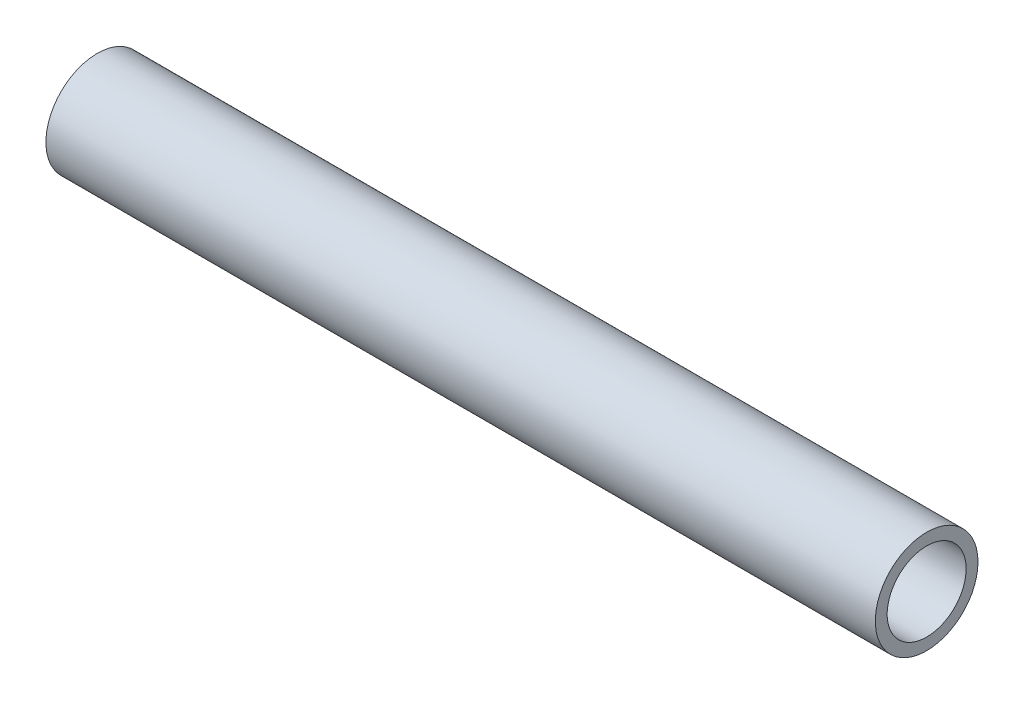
SolidWorks part; units mm, degrees
ref_plane "Front" through (0, 0, 0) normal (0, 0, 1) x (1, 0, 0)
ref_plane "Top" through (0, 0, 0) normal (0, 1, 0) x (1, 0, 0)
ref_plane "Right" through (0, 0, 0) normal (1, 0, 0) x (0, 0, -1)
sketch "Sketch1" plane through (0, 0, 0) normal (0, 0, 1) x (1, 0, 0)
  line L0 (0, 0) -> (266.7, 0)
  line L1 (9.9848, 0) -> (-9.9848, 0) construction
  dimension "D1" = 266.7
other "Structural Member1"
ref_plane "Plane1" through (0, 0, 0) normal (1, 0, 0) x (0, 0, -1)
sketch "Sketch11" plane through (0, 0, 0) normal (1, 0, 0) x (0, 0, -1)
  circle A0 centre (0, 0) radius 12.7
  circle A1 centre (0, 0) radius 16.51
  point P3 (0, 0)
  dimension "D1" = 33.02
  dimension "D2" = 25.4
